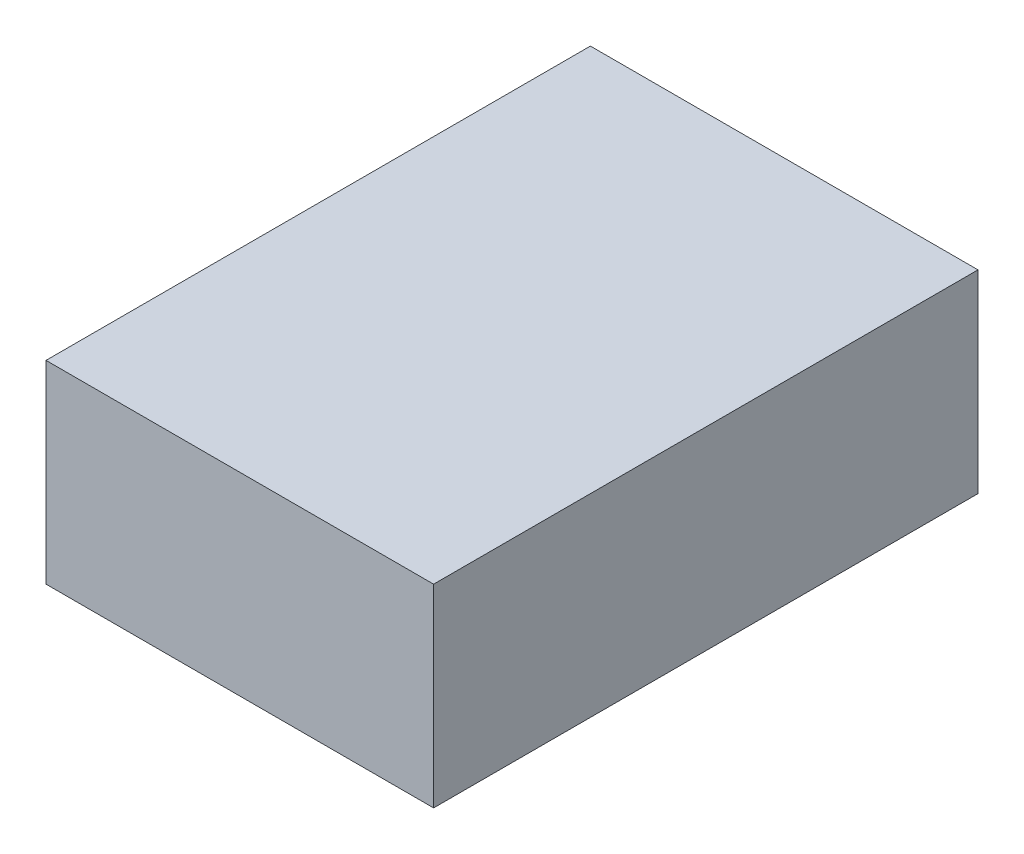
SolidWorks part; units mm, degrees
ref_plane "Front Plane" through (0, 0, 0) normal (0, 0, 1) x (1, 0, 0)
ref_plane "Top Plane" through (0, 0, 0) normal (0, 1, 0) x (1, 0, 0)
ref_plane "Right Plane" through (0, 0, 0) normal (1, 0, 0) x (0, 0, -1)
body saved out of another part "Stock-Mold Base with Cavity and Core-1"
